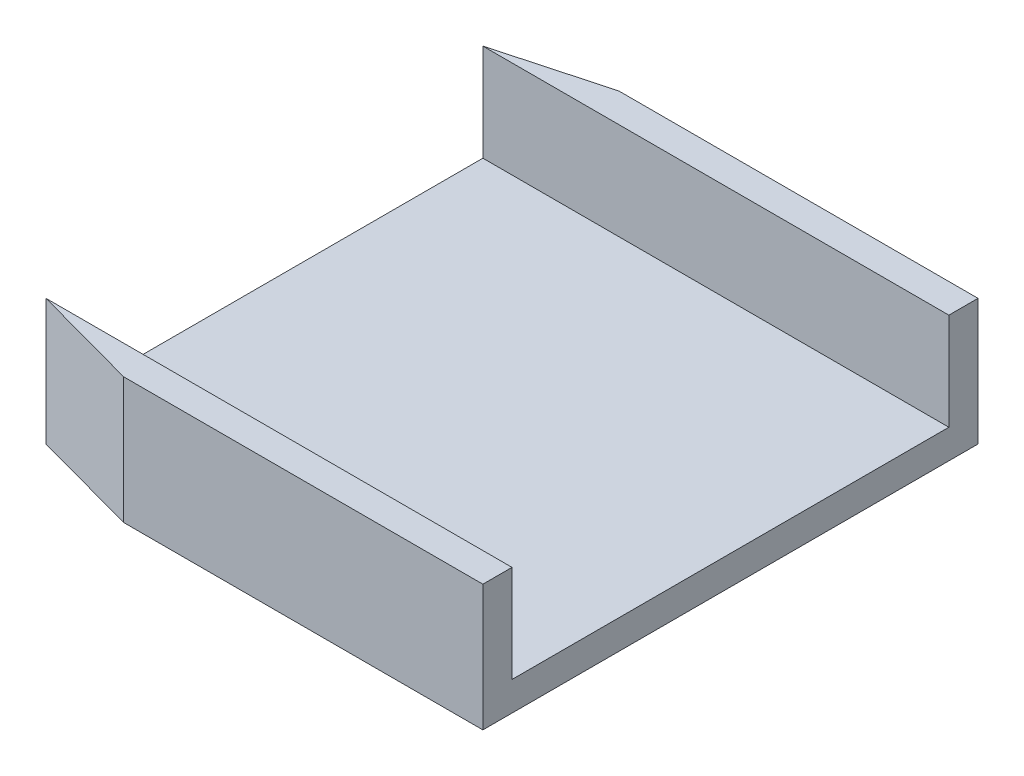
SolidWorks part; units mm, degrees
ref_plane "Front Plane" through (0, 0, 0) normal (0, 0, 1) x (1, 0, 0)
ref_plane "Top Plane" through (0, 0, 0) normal (0, 1, 0) x (1, 0, 0)
ref_plane "Right Plane" through (0, 0, 0) normal (1, 0, 0) x (0, 0, -1)
sketch "Sketch1" plane through (0, 0, 0) normal (0, 1, 0) x (1, 0, 0)
  line L0 (0, 0) -> (11, -3)
  line L1 (0, 0) -> (48, 0) construction
  line L2 (0, 0) -> (0, 45)
  line L3 (0, 45) -> (48, 45) construction
  line L4 (48, 0) -> (48, 45)
  line L5 (11, -3) -> (48, -3)
  line L6 (48, -3) -> (48, 0)
  line L7 (0, 22.5) -> (48, 22.5) construction
  line L8 (0, 45) -> (11, 48)
  line L9 (11, 48) -> (48, 48)
  line L10 (48, 48) -> (48, 45)
  dimension "D1" = 45
  dimension "D2" = 48
  dimension "D3" = 3
  dimension "D4" = 11
extrude "Boss-Extrude1" add sketch "Sketch1" along normal blind 3
sketch "Sketch2" plane through (0, 3, 0) normal (0, 1, 0) x (1, 0, 0)
  line L0 (0, 0) -> (48, 0)
  line L1 (48, -3) -> (48, 48) construction
  line L2 (48, 0) -> (48, -3)
  line L3 (48, -3) -> (11, -3)
  line L4 (11, -3) -> (0, 0)
  line L5 (0, 45) -> (11, 48)
  line L6 (11, 48) -> (48, 48)
  line L7 (48, 48) -> (48, 45)
  line L8 (48, 45) -> (0, 45)
extrude "Boss-Extrude2" add sketch "Sketch2" along normal blind 10
